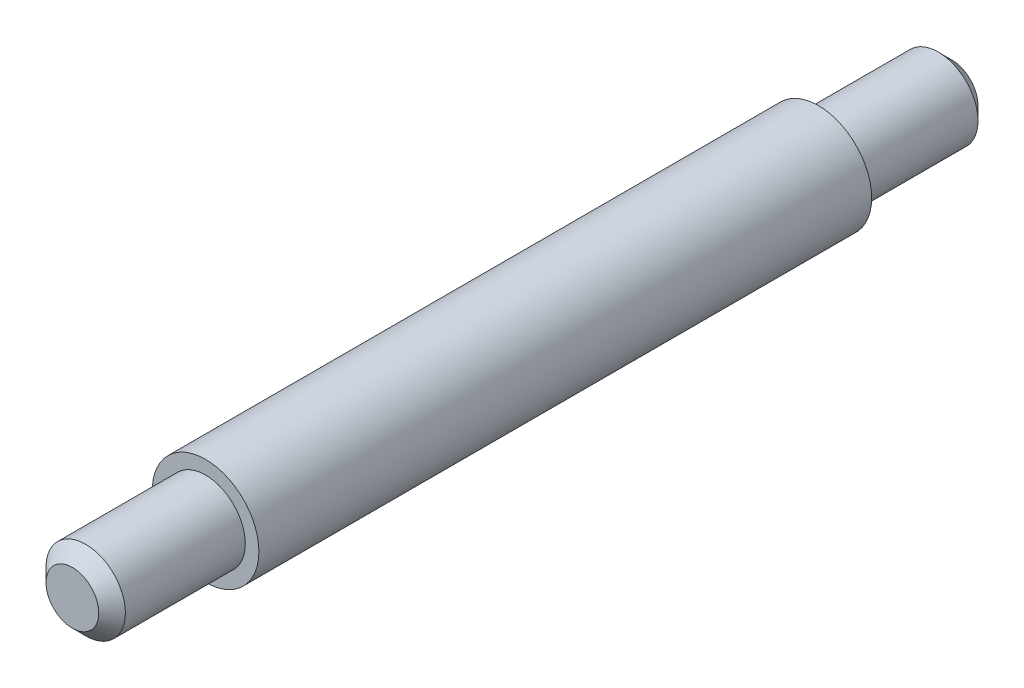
SolidWorks part; units mm, degrees
ref_plane "Front Plane" through (0, 0, 0) normal (0, 0, 1) x (1, 0, 0)
ref_plane "Top Plane" through (0, 0, 0) normal (0, 1, 0) x (1, 0, 0)
ref_plane "Right Plane" through (0, 0, 0) normal (1, 0, 0) x (0, 0, -1)
sketch "Sketch1" plane through (0, 0, 0) normal (0, 0, 1) x (1, 0, 0)
  circle A0 centre (0, 0) radius 2
  dimension "D1" = 4
extrude "Boss-Extrude1" add sketch "Sketch1" along normal mid plane 23
sketch "Sketch2" plane through (0, 0, 11.5) normal (0, 0, 1) x (1, 0, 0)
  circle A0 centre (0, 0) radius 1.49
  dimension "D1" = 2.98
extrude "Boss-Extrude2" add sketch "Sketch2" along normal blind 5
mirror "M3 threads" about plane through (0, 0, 0) normal (0, 0, 1) of "Boss-Extrude2"
chamfer "Chamfer1" distance 0.5 angle 45 2 edges at (1.49, 0, 16.5) (1.49, 0, -16.5)
